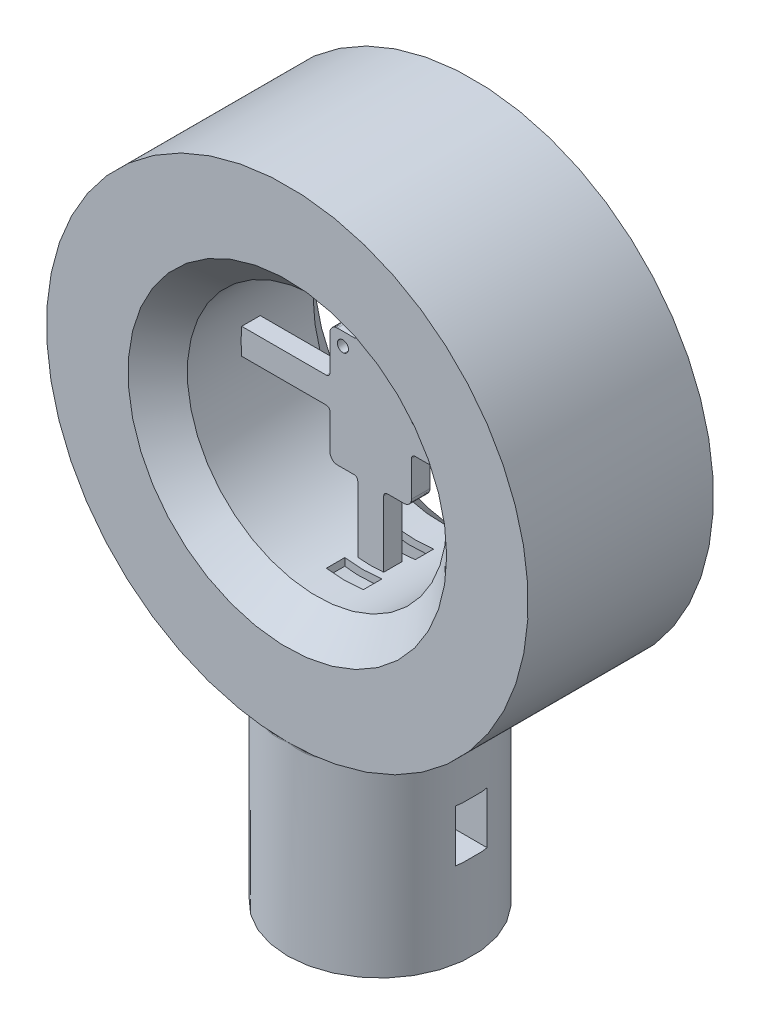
SolidWorks part; units mm, degrees
other "<臭屁探测器一级控件>-<<臭屁探测器>-<倒角2>>"
ref_plane "前视基准面" through (0, 0, 0) normal (0, 0, 1) x (1, 0, 0)
ref_plane "上视基准面" through (0, 0, 0) normal (0, 1, 0) x (1, 0, 0)
ref_plane "右视基准面" through (0, 0, 0) normal (1, 0, 0) x (0, 0, -1)
inserted part "臭屁探测器一级控件"
ref_plane "基准面2" through (0, 85, 0) normal (0, -1, 0) x (-1, 0, 0)
sketch "草图2" plane through (0, 85, 0) normal (0, -1, 0) x (-1, 0, 0)
  circle A0 centre (0, 0) radius 33.4748
extrude "切除-拉伸1" cut sketch "草图2" along normal blind 98
shell "抽壳1" thickness 2
sketch "草图3" plane through (0, 184, 0) normal (0, -1, 0) x (1, 0, 0)
  line L0 (-3.5, 2.5) -> (-3.5, -2.5) construction
  line L1 (-5, 9.5) -> (5, 9.5)
  line L2 (-5, 9.5) -> (-5, 4.5)
  line L3 (-5, 4.5) -> (5, 4.5)
  line L4 (5, 9.5) -> (5, 4.5)
  line L5 (-5, 9.5) -> (5, 4.5) construction
  line L6 (-5, 4.5) -> (5, 9.5) construction
  line L7 (-5, -4.5) -> (5, -4.5)
  line L8 (-5, -4.5) -> (-5, -9.5)
  line L9 (-5, -9.5) -> (5, -9.5)
  line L10 (5, -4.5) -> (5, -9.5)
  line L11 (-5, -4.5) -> (5, -9.5) construction
  line L12 (-5, -9.5) -> (5, -4.5) construction
  point P0 (0, 7)
  point P5 (0, -7)
  dimension "D1" = 7
  dimension "D2" = 7
  dimension "D3" = 10
extrude "切除-拉伸2" cut sketch "草图3" along normal blind 41
sketch "草图4" plane through (0, 0, 0) normal (1, 0, 0) x (0, 0, -1)
  line L0 (4.25, 122) -> (-4.25, 122) construction
  line L1 (-2, 127) -> (2, 127)
  line L2 (-2, 127) -> (-2, 117)
  line L3 (-2, 117) -> (2, 117)
  line L4 (2, 127) -> (2, 117)
  line L5 (-2, 127) -> (2, 117) construction
  line L6 (-2, 117) -> (2, 127) construction
  point P0 (0, 122)
  point P5 (0, 122)
  dimension "D1" = 4
  dimension "D2" = 10
extrude "切除-拉伸3" cut sketch "草图4" against normal blind 53
sketch "草图5" plane through (16, 0, 0) normal (1, 0, 0) x (0, 0, -1)
  line L0 (-4.25, 122) -> (4.25, 108) construction
  line L1 (-2.75, 120.5) -> (2.75, 120.5)
  line L2 (-2.75, 120.5) -> (-2.75, 109.5)
  line L3 (-2.75, 109.5) -> (2.75, 109.5)
  line L4 (2.75, 120.5) -> (2.75, 109.5)
  line L5 (-2.75, 120.5) -> (2.75, 109.5) construction
  line L6 (-2.75, 109.5) -> (2.75, 120.5) construction
  line L7 (-4.25, 122) -> (4.25, 122) construction
  line L8 (-4.25, 122) -> (-4.25, 108) construction
  point P0 (0, 115)
  point P5 (0, 115)
  dimension "D1" = 1.5
  dimension "D2" = 1.5
extrude "切除-拉伸6" cut sketch "草图5" against normal blind 7
